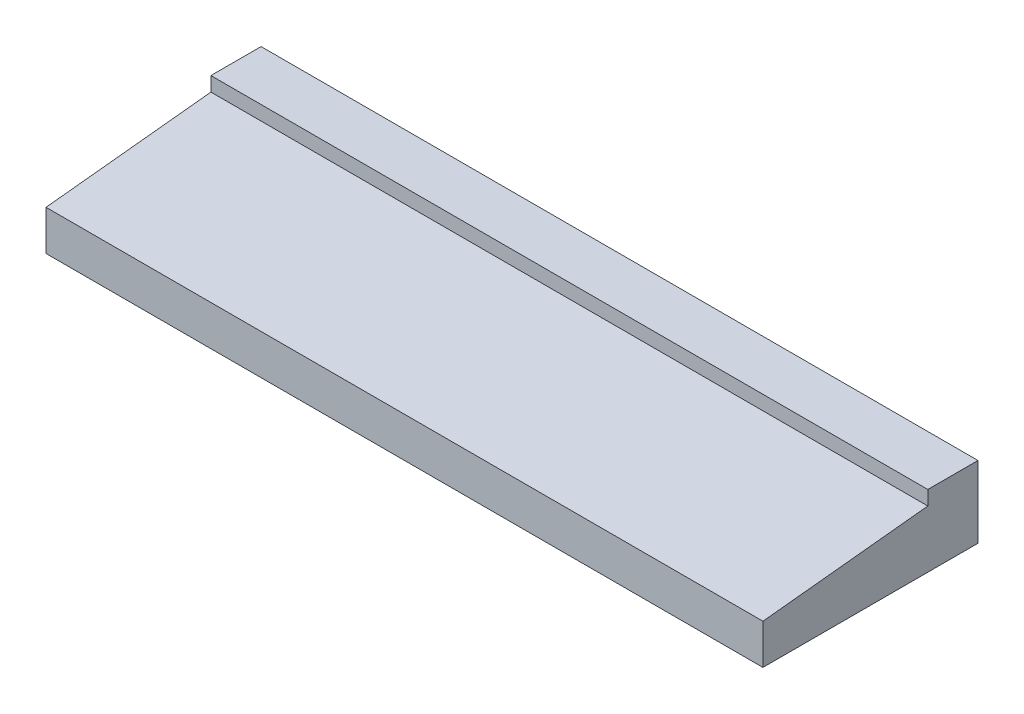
SolidWorks part; units mm, degrees
ref_plane "Plan de face" through (0, 0, 0) normal (0, 0, 1) x (1, 0, 0)
ref_plane "Plan de dessus" through (0, 0, 0) normal (0, 1, 0) x (1, 0, 0)
ref_plane "Plan de droite" through (0, 0, 0) normal (1, 0, 0) x (0, 0, -1)
sketch "Esquisse1" plane through (0, 0, 0) normal (1, 0, 0) x (0, 0, -1)
  line L0 (0, -3.6995) -> (0, 19.531) construction
  line L1 (-6.2478, 0) -> (36.6393, 0) construction
  line L2 (30, -3.6995) -> (30, 19.531) construction
  line L3 (23, 19.531) -> (23, 3.8312) construction
  line L4 (36.6393, 10) -> (-6.2478, 10) construction
  line L5 (-6.2478, 4) -> (10.5369, 4) construction
  line L6 (32.7462, 8) -> (21.6416, 8) construction
  line L7 (0, 0) -> (0.0029, 5.5829)
  line L8 (23, 8) -> (0.0029, 5.5829) construction
  line L9 (23, 8) -> (23, 10)
  line L10 (23, 10) -> (30, 10)
  line L11 (30, 10) -> (30, 0)
  line L12 (30, 0) -> (0, 0)
  line L13 (23, 8) -> (0.0029, 5.5829)
  dimension "D6" = 6
  dimension "D1" = 10
  dimension "D2" = 2
  dimension "D3" = 4
  dimension "D4" = 7
  dimension "D5" = 30
extrude "Extrusion1" add sketch "Esquisse1" along normal blind 100
